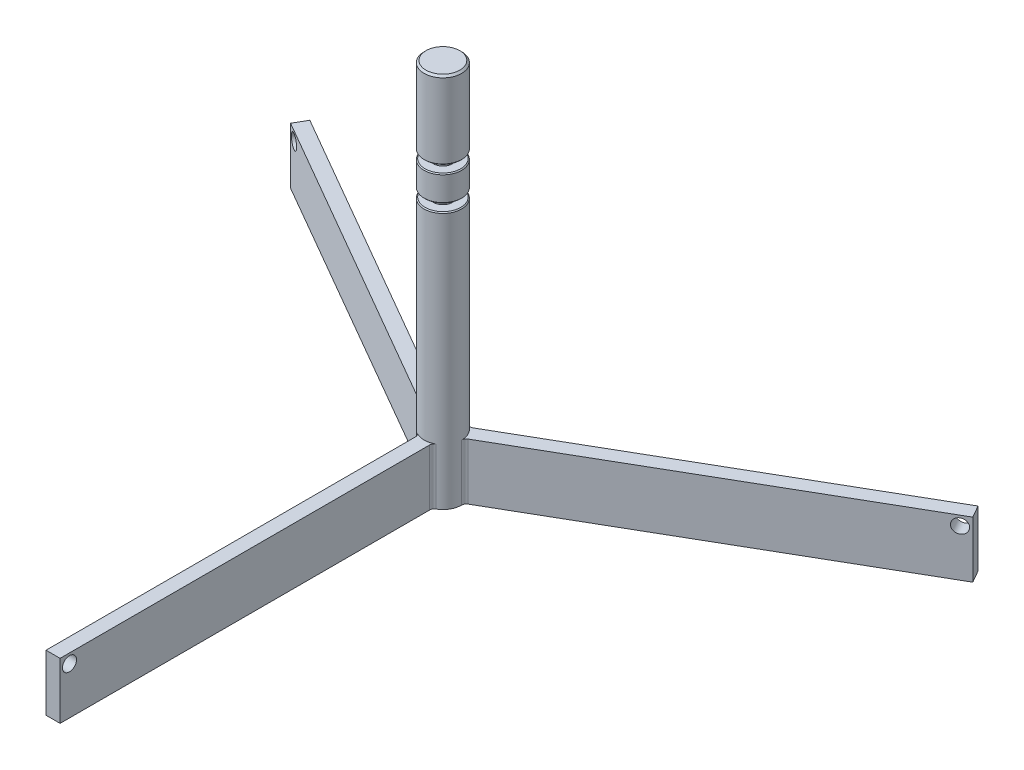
SolidWorks part; units mm, degrees
ref_plane "Front" through (0, 0, 0) normal (0, 0, 1) x (1, 0, 0)
ref_plane "Top" through (0, 0, 0) normal (0, 1, 0) x (1, 0, 0)
ref_plane "Right" through (0, 0, 0) normal (1, 0, 0) x (0, 0, -1)
sketch "Sketch5" plane through (0, 0, 0) normal (0, 0, 1) x (1, 0, 0)
  line L0 (0, 112.3855) -> (0, -102.7942) construction
  line L1 (12.7, 173.99) -> (6.35, 173.99)
  line L2 (0, 0) -> (12.7, 0)
  line L3 (0, 0) -> (0, 254)
  line L4 (0, 254) -> (12.7, 254)
  line L5 (12.7, 0) -> (12.7, 173.99)
  line L6 (6.35, 173.99) -> (6.35, 179.07)
  line L7 (6.35, 179.07) -> (12.7, 179.07)
  line L8 (12.7, 196.596) -> (6.35, 196.596)
  line L9 (6.35, 196.596) -> (6.35, 201.676)
  line L10 (6.35, 201.676) -> (12.7, 201.676)
  line L11 (12.7, 179.07) -> (12.7, 196.596)
  line L12 (12.7, 201.676) -> (12.7, 254)
  dimension "D1" = 254
  dimension "D2" = 12.7
  dimension "D3" = 6.35
  dimension "D4" = 5.08
  dimension "D5" = 74.93
  dimension "D6" = 52.324
revolve "Base-Revolve" add sketch "Sketch5" angle 360 about L0
sketch "Sketch6" plane through (0, 0, 0) normal (0, 0, 1) x (1, 0, 0)
  line L1 (-4.7625, 0) -> (4.7625, 0)
  line L2 (-4.7625, 0) -> (-4.7625, 38.1)
  line L3 (-4.7625, 38.1) -> (4.7625, 38.1)
  line L4 (4.7625, 0) -> (4.7625, 38.1)
  point P4 (0, 0)
  dimension "D1" = 38.1
  dimension "D2" = 9.525
extrude "Boss-Extrude2" add sketch "Sketch6" along normal blind 263.525
sketch "Sketch7" plane through (4.7625, 0, 0) normal (1, 0, 0) x (0, 0, -1)
  line L0 (-263.525, 0) -> (-263.525, 38.1) construction
  line L1 (-263.525, 38.1) -> (-11.7732, 38.1) construction
  circle A0 centre (-257.175, 31.75) radius 4.7625
  dimension "D1" = 9.525
  dimension "D2" = 6.35
  dimension "D3" = 6.35
extrude "Cut-Extrude2" cut sketch "Sketch7" against normal through all
fillet "Fillet2" radius 3.175 2 edges at (-4.7625, 19.05, 11.7732) (4.7625, 19.05, 11.7732)
pattern_circular "CirPattern2" count 3 over 360 about axis through (0, 0, 0) along (0, 1, 0) of "Fillet2", "Cut-Extrude2", "Boss-Extrude2"
chamfer "Chamfer5" distance 0.635 angle 45 4 edges at (0, 201.676, 12.7) (0, 173.99, 12.7) (0, 179.07, 12.7) (0, 196.596, 12.7)
chamfer "Chamfer6" distance 1.27 angle 45 1 edges at (0, 254, 12.7)
